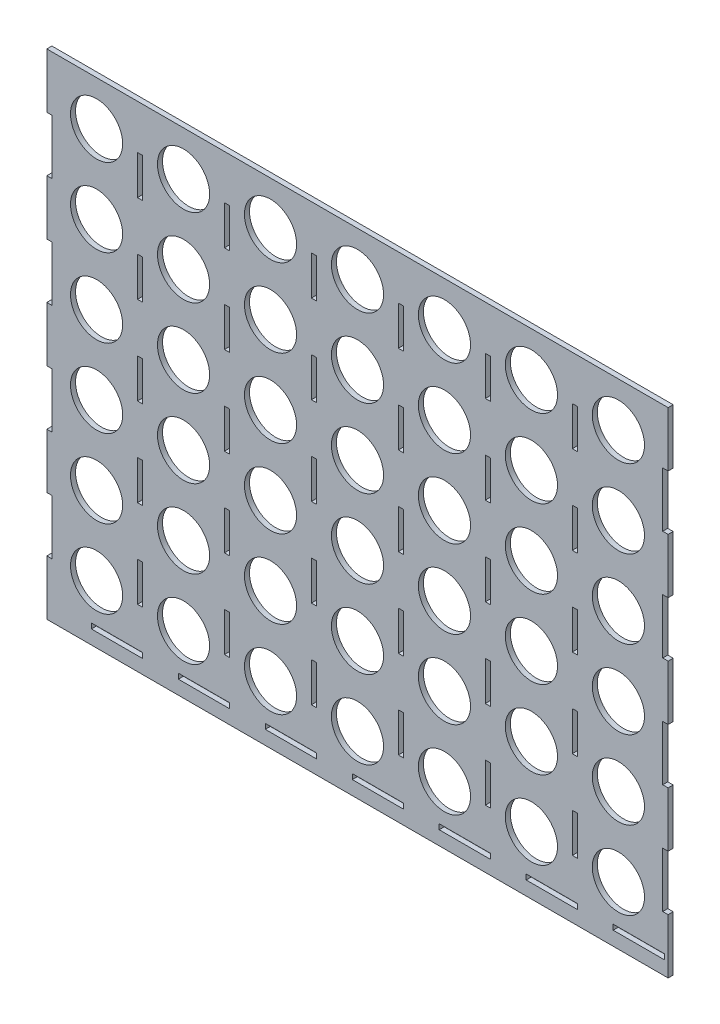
SolidWorks part; units mm, degrees
ref_plane "Plan de face" through (0, 0, 0) normal (0, 0, 1) x (1, 0, 0)
ref_plane "Plan de dessus" through (0, 0, 0) normal (0, 1, 0) x (1, 0, 0)
ref_plane "Plan de droite" through (0, 0, 0) normal (1, 0, 0) x (0, 0, -1)
sketch "Esquisse1" plane through (0, 0, 0) normal (0, 0, 1) x (1, 0, 0)
  line L0 (-178.6, 142) -> (178.6, -142) construction
  line L1 (-178.6, 142) -> (178.6, 142)
  line L2 (-178.6, 142) -> (-178.6, 110.4444)
  line L3 (-178.6, -142) -> (178.6, -142)
  line L5 (-178.6, 78.8889) -> (-178.6, 47.3333)
  line L6 (-178.6, 110.4444) -> (-175.5, 110.4444)
  line L8 (-178.6, 78.8889) -> (-175.5, 78.8889)
  line L9 (-175.5, 110.4444) -> (-175.5, 78.8889)
  line L10 (-178.6, 47.3333) -> (-175.5, 47.3333)
  line L12 (-178.6, 15.7778) -> (-175.5, 15.7778)
  line L13 (-175.5, 47.3333) -> (-175.5, 15.7778)
  line L14 (-178.6, -15.7778) -> (-175.5, -15.7778)
  line L16 (-178.6, -47.3333) -> (-175.5, -47.3333)
  line L17 (-175.5, -15.7778) -> (-175.5, -47.3333)
  line L18 (-178.6, -78.8889) -> (-175.5, -78.8889)
  line L20 (-178.6, -110.4444) -> (-175.5, -110.4444)
  line L21 (-175.5, -78.8889) -> (-175.5, -110.4444)
  line L22 (-178.6, 15.7778) -> (-178.6, -15.7778)
  line L23 (-178.6, -47.3333) -> (-178.6, -78.8889)
  line L24 (-178.6, -110.4444) -> (-178.6, -142)
  line L25 (0, 0) -> (0, -142) construction
  line L26 (-153, -134) -> (-123.5, -134)
  line L27 (-153, -134) -> (-153, -131)
  line L28 (-153, -131) -> (-123.5, -131)
  line L29 (-123.5, -134) -> (-123.5, -131)
  line L34 (178.6, -110.4444) -> (178.6, -142)
  line L35 (178.6, -47.3333) -> (178.6, -78.8889)
  line L36 (178.6, 15.7778) -> (178.6, -15.7778)
  line L38 (178.6, -110.4444) -> (175.5, -110.4444)
  line L39 (178.6, -78.8889) -> (175.5, -78.8889)
  line L40 (175.5, -15.7778) -> (175.5, -47.3333)
  line L41 (178.6, -47.3333) -> (175.5, -47.3333)
  line L42 (178.6, -15.7778) -> (175.5, -15.7778)
  line L43 (175.5, 47.3333) -> (175.5, 15.7778)
  line L44 (178.6, 15.7778) -> (175.5, 15.7778)
  line L45 (178.6, 47.3333) -> (175.5, 47.3333)
  line L46 (175.5, 110.4444) -> (175.5, 78.8889)
  line L47 (178.6, 78.8889) -> (175.5, 78.8889)
  line L48 (178.6, 110.4444) -> (175.5, 110.4444)
  line L49 (178.6, 78.8889) -> (178.6, 47.3333)
  line L50 (178.6, 142) -> (178.6, 110.4444)
  line L51 (-122.5, -85) -> (-122.5, -109.5) construction
  line L52 (-126.5, -86) -> (-123.5, -86)
  line L53 (-126.5, -86) -> (-126.5, -108.5)
  line L54 (-126.5, -108.5) -> (-123.5, -108.5)
  line L55 (-123.5, -86) -> (-123.5, -108.5)
  line L56 (-127.5, -109.5) -> (-122.5, -109.5) construction
  line L57 (-127.5, -85) -> (-127.5, -109.5) construction
  line L58 (-127.5, -85) -> (-122.5, -85) construction
  line L59 (-172.5, -108.5) -> (-172.5, -115.7923) construction
  line L60 (-150, 139) -> (-122.6833, 139) construction
  line L61 (-126.5, -57.875) -> (-123.5, -57.875)
  line L62 (-123.5, -35.375) -> (-123.5, -57.875)
  line L63 (-126.5, -35.375) -> (-126.5, -57.875)
  line L64 (-126.5, -35.375) -> (-123.5, -35.375)
  line L65 (-126.5, -7.25) -> (-123.5, -7.25)
  line L66 (-123.5, 15.25) -> (-123.5, -7.25)
  line L67 (-126.5, 15.25) -> (-126.5, -7.25)
  line L68 (-126.5, 15.25) -> (-123.5, 15.25)
  line L69 (-126.5, 43.375) -> (-123.5, 43.375)
  line L70 (-123.5, 65.875) -> (-123.5, 43.375)
  line L71 (-126.5, 65.875) -> (-126.5, 43.375)
  line L72 (-126.5, 65.875) -> (-123.5, 65.875)
  line L73 (-126.5, 94) -> (-123.5, 94)
  line L74 (-123.5, 116.5) -> (-123.5, 94)
  line L75 (-126.5, 116.5) -> (-126.5, 94)
  line L76 (-126.5, 116.5) -> (-123.5, 116.5)
  line L77 (-73.5, -86) -> (-73.5, -108.5)
  line L78 (-76.5, -86) -> (-76.5, -108.5)
  line L79 (-76.5, -86) -> (-73.5, -86)
  line L80 (-76.5, -108.5) -> (-73.5, -108.5)
  line L81 (-76.5, -35.375) -> (-76.5, -57.875)
  line L82 (-73.5, -35.375) -> (-73.5, -57.875)
  line L83 (-76.5, -35.375) -> (-73.5, -35.375)
  line L84 (-76.5, -57.875) -> (-73.5, -57.875)
  line L85 (-76.5, -7.25) -> (-73.5, -7.25)
  line L86 (-73.5, 15.25) -> (-73.5, -7.25)
  line L87 (-76.5, 15.25) -> (-76.5, -7.25)
  line L88 (-76.5, 15.25) -> (-73.5, 15.25)
  line L89 (-76.5, 43.375) -> (-73.5, 43.375)
  line L90 (-73.5, 65.875) -> (-73.5, 43.375)
  line L91 (-76.5, 65.875) -> (-76.5, 43.375)
  line L92 (-76.5, 65.875) -> (-73.5, 65.875)
  line L93 (-76.5, 94) -> (-73.5, 94)
  line L94 (-73.5, 116.5) -> (-73.5, 94)
  line L95 (-76.5, 116.5) -> (-76.5, 94)
  line L96 (-76.5, 116.5) -> (-73.5, 116.5)
  line L97 (-23.5, -86) -> (-23.5, -108.5)
  line L98 (-26.5, -86) -> (-26.5, -108.5)
  line L99 (-26.5, -86) -> (-23.5, -86)
  line L100 (-26.5, -108.5) -> (-23.5, -108.5)
  line L101 (-26.5, -35.375) -> (-26.5, -57.875)
  line L102 (-23.5, -35.375) -> (-23.5, -57.875)
  line L103 (-26.5, -35.375) -> (-23.5, -35.375)
  line L104 (-26.5, -57.875) -> (-23.5, -57.875)
  line L105 (-26.5, -7.25) -> (-23.5, -7.25)
  line L106 (-23.5, 15.25) -> (-23.5, -7.25)
  line L107 (-26.5, 15.25) -> (-26.5, -7.25)
  line L108 (-26.5, 15.25) -> (-23.5, 15.25)
  line L109 (-26.5, 43.375) -> (-23.5, 43.375)
  line L110 (-23.5, 65.875) -> (-23.5, 43.375)
  line L111 (-26.5, 65.875) -> (-26.5, 43.375)
  line L112 (-26.5, 65.875) -> (-23.5, 65.875)
  line L113 (-26.5, 94) -> (-23.5, 94)
  line L114 (-23.5, 116.5) -> (-23.5, 94)
  line L115 (-26.5, 116.5) -> (-26.5, 94)
  line L116 (-26.5, 116.5) -> (-23.5, 116.5)
  line L117 (26.5, -86) -> (26.5, -108.5)
  line L118 (23.5, -86) -> (23.5, -108.5)
  line L119 (23.5, -86) -> (26.5, -86)
  line L120 (23.5, -108.5) -> (26.5, -108.5)
  line L121 (23.5, -35.375) -> (23.5, -57.875)
  line L122 (26.5, -35.375) -> (26.5, -57.875)
  line L123 (23.5, -35.375) -> (26.5, -35.375)
  line L124 (23.5, -57.875) -> (26.5, -57.875)
  line L125 (23.5, -7.25) -> (26.5, -7.25)
  line L126 (26.5, 15.25) -> (26.5, -7.25)
  line L127 (23.5, 15.25) -> (23.5, -7.25)
  line L128 (23.5, 15.25) -> (26.5, 15.25)
  line L129 (23.5, 43.375) -> (26.5, 43.375)
  line L130 (26.5, 65.875) -> (26.5, 43.375)
  line L131 (23.5, 65.875) -> (23.5, 43.375)
  line L132 (23.5, 65.875) -> (26.5, 65.875)
  line L133 (23.5, 94) -> (26.5, 94)
  line L134 (26.5, 116.5) -> (26.5, 94)
  line L135 (23.5, 116.5) -> (23.5, 94)
  line L136 (23.5, 116.5) -> (26.5, 116.5)
  line L137 (76.5, -86) -> (76.5, -108.5)
  line L138 (73.5, -86) -> (73.5, -108.5)
  line L139 (73.5, -86) -> (76.5, -86)
  line L140 (73.5, -108.5) -> (76.5, -108.5)
  line L141 (73.5, -35.375) -> (73.5, -57.875)
  line L142 (76.5, -35.375) -> (76.5, -57.875)
  line L143 (73.5, -35.375) -> (76.5, -35.375)
  line L144 (73.5, -57.875) -> (76.5, -57.875)
  line L145 (73.5, -7.25) -> (76.5, -7.25)
  line L146 (76.5, 15.25) -> (76.5, -7.25)
  line L147 (73.5, 15.25) -> (73.5, -7.25)
  line L148 (73.5, 15.25) -> (76.5, 15.25)
  line L149 (73.5, 43.375) -> (76.5, 43.375)
  line L150 (76.5, 65.875) -> (76.5, 43.375)
  line L151 (73.5, 65.875) -> (73.5, 43.375)
  line L152 (73.5, 65.875) -> (76.5, 65.875)
  line L153 (73.5, 94) -> (76.5, 94)
  line L154 (76.5, 116.5) -> (76.5, 94)
  line L155 (73.5, 116.5) -> (73.5, 94)
  line L156 (73.5, 116.5) -> (76.5, 116.5)
  line L157 (126.5, -86) -> (126.5, -108.5)
  line L158 (123.5, -86) -> (123.5, -108.5)
  line L159 (123.5, -86) -> (126.5, -86)
  line L160 (123.5, -108.5) -> (126.5, -108.5)
  line L161 (123.5, -35.375) -> (123.5, -57.875)
  line L162 (126.5, -35.375) -> (126.5, -57.875)
  line L163 (123.5, -35.375) -> (126.5, -35.375)
  line L164 (123.5, -57.875) -> (126.5, -57.875)
  line L165 (123.5, -7.25) -> (126.5, -7.25)
  line L166 (126.5, 15.25) -> (126.5, -7.25)
  line L167 (123.5, 15.25) -> (123.5, -7.25)
  line L168 (123.5, 15.25) -> (126.5, 15.25)
  line L169 (123.5, 43.375) -> (126.5, 43.375)
  line L170 (126.5, 65.875) -> (126.5, 43.375)
  line L171 (123.5, 65.875) -> (123.5, 43.375)
  line L172 (123.5, 65.875) -> (126.5, 65.875)
  line L173 (123.5, 94) -> (126.5, 94)
  line L174 (126.5, 116.5) -> (126.5, 94)
  line L175 (123.5, 116.5) -> (123.5, 94)
  line L176 (123.5, 116.5) -> (126.5, 116.5)
  line L197 (176.5, -86) -> (176.5, -108.5)
  line L198 (173.5, -86) -> (176.5, -86)
  line L199 (173.5, -108.5) -> (176.5, -108.5)
  line L200 (173.5, -86) -> (173.5, -108.5)
  line L203 (175.5, -78.8889) -> (175.5, -110.4444)
  line L204 (-150, -131) -> (-150, -134) construction
  line L205 (176.5, -35.375) -> (176.5, -57.875)
  line L206 (173.5, -57.875) -> (176.5, -57.875)
  line L207 (173.5, -35.375) -> (173.5, -57.875)
  line L208 (173.5, -35.375) -> (176.5, -35.375)
  line L209 (173.5, -7.25) -> (176.5, -7.25)
  line L210 (173.5, 15.25) -> (173.5, -7.25)
  line L211 (173.5, 15.25) -> (176.5, 15.25)
  line L212 (176.5, 15.25) -> (176.5, -7.25)
  line L213 (173.5, 43.375) -> (176.5, 43.375)
  line L214 (176.5, 65.875) -> (176.5, 43.375)
  line L215 (173.5, 65.875) -> (173.5, 43.375)
  line L216 (173.5, 65.875) -> (176.5, 65.875)
  line L217 (173.5, 116.5) -> (176.5, 116.5)
  line L218 (173.5, 116.5) -> (173.5, 94)
  line L219 (176.5, 116.5) -> (176.5, 94)
  line L220 (173.5, 94) -> (176.5, 94)
  line L225 (-50, -108.5) -> (-50, -134) construction
  line L230 (-103, -134) -> (-73.5, -134)
  line L231 (-103, -134) -> (-103, -131)
  line L232 (-103, -131) -> (-73.5, -131)
  line L233 (-73.5, -134) -> (-73.5, -131)
  line L234 (-53, -134) -> (-23.5, -134)
  line L235 (-53, -134) -> (-53, -131)
  line L236 (-53, -131) -> (-23.5, -131)
  line L237 (-23.5, -134) -> (-23.5, -131)
  line L238 (-3, -134) -> (26.5, -134)
  line L239 (-3, -134) -> (-3, -131)
  line L240 (-3, -131) -> (26.5, -131)
  line L241 (26.5, -134) -> (26.5, -131)
  line L242 (47, -134) -> (76.5, -134)
  line L243 (47, -134) -> (47, -131)
  line L244 (47, -131) -> (76.5, -131)
  line L245 (76.5, -134) -> (76.5, -131)
  line L246 (97, -134) -> (126.5, -134)
  line L247 (97, -134) -> (97, -131)
  line L248 (97, -131) -> (126.5, -131)
  line L249 (126.5, -134) -> (126.5, -131)
  line L250 (147, -134) -> (176.5, -134)
  line L251 (147, -134) -> (147, -131)
  line L252 (147, -131) -> (176.5, -131)
  line L253 (176.5, -134) -> (176.5, -131)
  line L254 (-150, -132.5) -> (-153, -132.5) construction
  line L255 (-103, -132.5) -> (-100, -132.5) construction
  circle A0 centre (-150, -108.5) radius 15
  circle A1 centre (-150, -108.5) radius 22.5 construction
  circle A2 centre (-100, -108.5) radius 15
  circle A3 centre (-100, -108.5) radius 22.5 construction
  circle A4 centre (-50, -108.5) radius 15
  circle A5 centre (-50, -108.5) radius 22.5 construction
  circle A6 centre (0, -108.5) radius 15
  circle A7 centre (0, -108.5) radius 22.5 construction
  circle A8 centre (50, -108.5) radius 15
  circle A9 centre (50, -108.5) radius 22.5 construction
  circle A10 centre (100, -108.5) radius 15
  circle A11 centre (100, -108.5) radius 22.5 construction
  circle A12 centre (150, -108.5) radius 15
  circle A13 centre (150, -108.5) radius 22.5 construction
  circle A14 centre (-150, -63.5) radius 15
  circle A15 centre (-150, -63.5) radius 22.5 construction
  circle A16 centre (-150, -18.5) radius 15
  circle A17 centre (-150, -18.5) radius 22.5 construction
  circle A18 centre (-150, 26.5) radius 15
  circle A19 centre (-150, 26.5) radius 22.5 construction
  circle A20 centre (-150, 71.5) radius 15
  circle A21 centre (-150, 71.5) radius 22.5 construction
  circle A22 centre (-150, 116.5) radius 15
  circle A23 centre (-150, 116.5) radius 22.5 construction
  circle A24 centre (-100, -63.5) radius 15
  circle A25 centre (-100, -18.5) radius 15
  circle A26 centre (-100, 26.5) radius 15
  circle A27 centre (-100, 71.5) radius 15
  circle A28 centre (-100, 116.5) radius 15
  circle A29 centre (-50, -63.5) radius 15
  circle A30 centre (-50, -18.5) radius 15
  circle A31 centre (-50, 26.5) radius 15
  circle A32 centre (-50, 71.5) radius 15
  circle A33 centre (-50, 116.5) radius 15
  circle A34 centre (0, -63.5) radius 15
  circle A35 centre (0, -18.5) radius 15
  circle A36 centre (0, 26.5) radius 15
  circle A37 centre (0, 71.5) radius 15
  circle A38 centre (0, 116.5) radius 15
  circle A39 centre (50, -63.5) radius 15
  circle A40 centre (50, -18.5) radius 15
  circle A41 centre (50, 26.5) radius 15
  circle A42 centre (50, 71.5) radius 15
  circle A43 centre (50, 116.5) radius 15
  circle A44 centre (100, -63.5) radius 15
  circle A45 centre (100, -18.5) radius 15
  circle A46 centre (100, 26.5) radius 15
  circle A47 centre (100, 71.5) radius 15
  circle A48 centre (100, 116.5) radius 15
  circle A49 centre (150, -63.5) radius 15
  circle A50 centre (150, -18.5) radius 15
  circle A51 centre (150, 26.5) radius 15
  circle A52 centre (150, 71.5) radius 15
  circle A53 centre (150, 116.5) radius 15
  dimension "D1" = 30
  dimension "D6" = 45
  dimension "D10" = 6
  dimension "D2" = 3.1
  dimension "D3" = 3
  dimension "D4" = 7
  dimension "D5" = 3
  dimension "D9" = 3
  dimension "D11" = 8
  dimension "D12" = 6
  dimension "D15" = 3
  dimension "D8" = 1
  dimension "D7" = 7
  dimension "D13" = 5
  dimension "D14" = 7
extrude "Boss.-Extru.1" add sketch "Esquisse1" along normal blind 2.9
